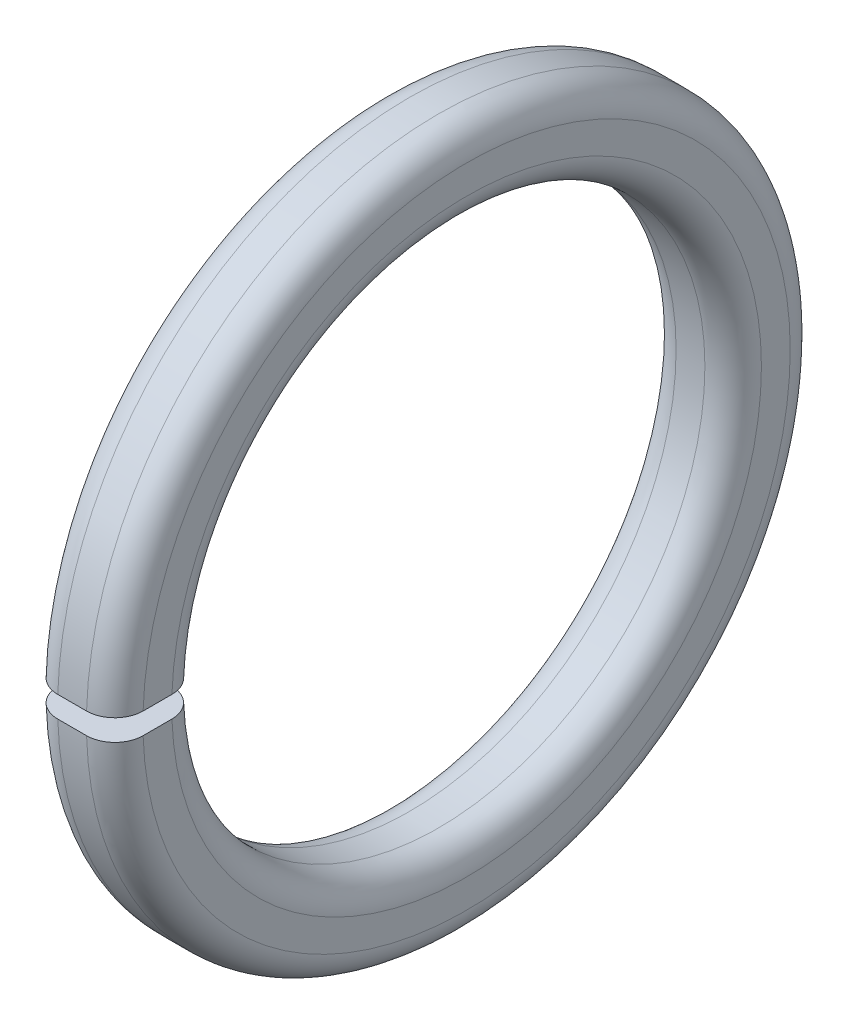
SolidWorks part; units mm, degrees
ref_plane "Plane1" through (0, 0, 0) normal (0, 0, 1) x (1, 0, 0)
ref_plane "Plane2" through (0, 0, 0) normal (0, 1, 0) x (1, 0, 0)
ref_plane "Plane3" through (0, 0, 0) normal (1, 0, 0) x (0, 0, -1)
sketch "Sketch1" plane through (0, 0, 0) normal (0, 0, 1) x (1, 0, 0)
  line L0 (-34.925, 0) -> (9.525, 0) construction
  line L1 (0, 27.65) -> (0, 30.35)
  line L2 (-2.65, 33) -> (-5.35, 33)
  line L3 (-8, 30.35) -> (-8, 27.65)
  line L4 (-5.35, 25) -> (-2.65, 25)
  arc A0 (-5.35, 25) -> (-8, 27.65) centre (-5.35, 27.65) cw
  arc A1 (0, 27.65) -> (-2.65, 25) centre (-2.65, 27.65) cw
  arc A2 (0, 30.35) -> (-2.65, 33) centre (-2.65, 30.35) ccw
  arc A3 (-5.35, 33) -> (-8, 30.35) centre (-5.35, 30.35) ccw
  point P8 (-8, 25)
  point P14 (0, 33)
  point P17 (-8, 33)
  dimension "Fillet_rad" = 2.65
  dimension "Thickness" = 8
  dimension "Inside_dia" = 50
  dimension "Outside_dia" = 66
revolve "Base-Revolve" add sketch "Sketch1" angle 360 about L0
sketch "Sketch2" plane through (0, 0, 0) normal (-1, 0, 0) x (0, -1, 0)
  line L0 (-1, 0) -> (1, 0)
  line L1 (0, 0) -> (0, 12.7) construction
  line L2 (1, 0) -> (1, 33.66)
  line L3 (1, 33.66) -> (-1, 33.66)
  line L4 (-1, 33.66) -> (-1, 0)
  dimension "D1" = 2
  dimension "D2" = 33.66
extrude "Gap" cut sketch "Sketch2" along normal through all
equation "\"D1@Sketch2\" = \"Thickness@Sketch1\" * 0.25"
equation "\"Outside_dia@Sketch1\" = \"Inside_dia@Sketch1\" + 2.0 * \"Thickness@Sketch1\""
equation "\"D2@Sketch2\" = \"Outside_dia@Sketch1\" * 0.51"
